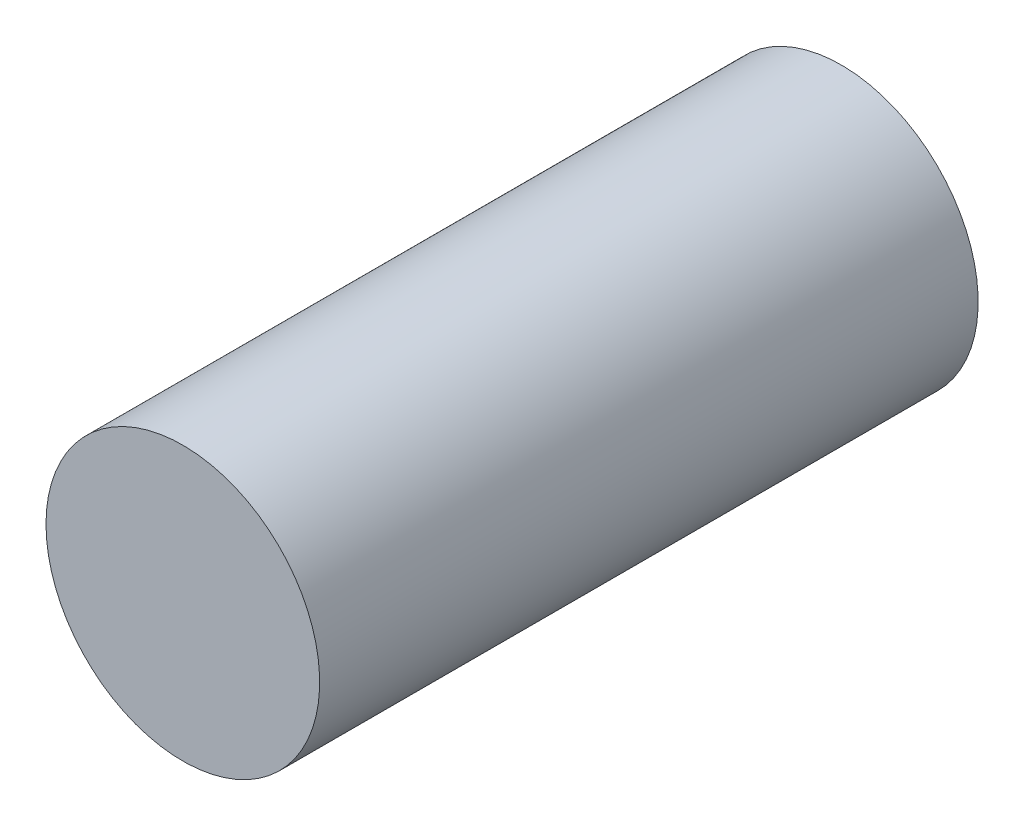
SolidWorks part; units mm, degrees
ref_plane "Plan de face" through (0, 0, 0) normal (0, 0, 1) x (1, 0, 0)
ref_plane "Plan de dessus" through (0, 0, 0) normal (0, 1, 0) x (1, 0, 0)
ref_plane "Plan de droite" through (0, 0, 0) normal (1, 0, 0) x (0, 0, -1)
sketch "Esquisse1" plane through (0, 0, 0) normal (0, 0, 1) x (1, 0, 0)
  circle A0 centre (0, 0) radius 0.8
  dimension "D1" = 1.6
extrude "Extrusion1" add sketch "Esquisse1" along normal blind 3.85
